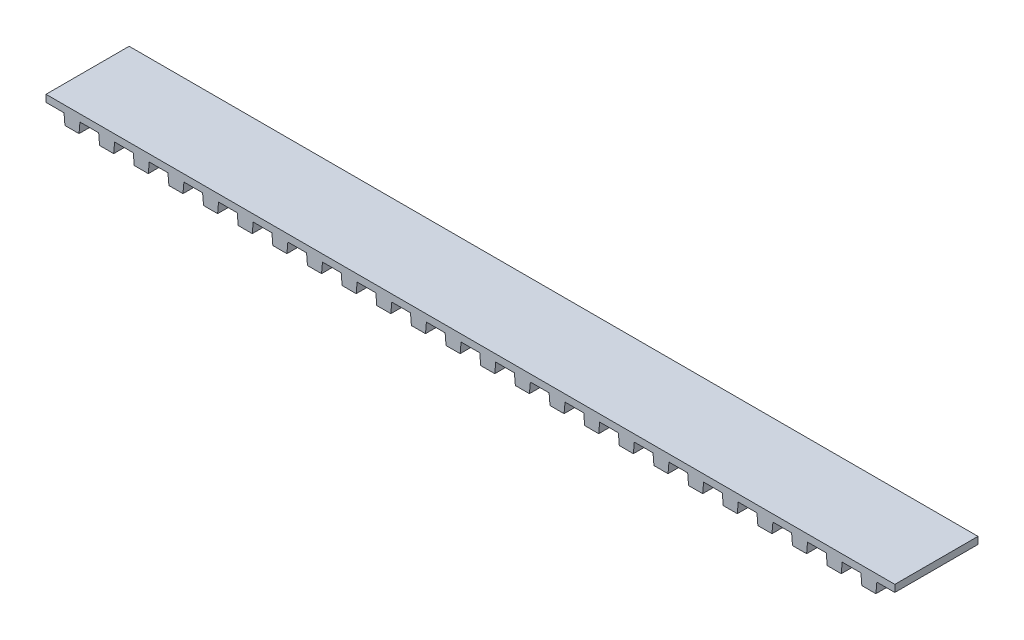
SolidWorks part; units mm, degrees
ref_plane "Front" through (0, 0, 0) normal (0, 0, 1) x (1, 0, 0)
ref_plane "Top" through (0, 0, 0) normal (0, 1, 0) x (1, 0, 0)
ref_plane "Right" through (0, 0, 0) normal (1, 0, 0) x (0, 0, -1)
sketch "Sketch1" plane through (0, 0, 0) normal (0, 0, 1) x (1, 0, 0)
  line L1 (0, 0.762) -> (30.625, 0.762)
  line L2 (0, 0.762) -> (0, 1.27)
  line L3 (0, 1.27) -> (30.625, 1.27)
  line L4 (30.625, 0.762) -> (30.625, 1.27)
  dimension "D1" = 30.625
  dimension "D2" = 0.508
  dimension "D3" = 0.762
extrude "Extrude1" add sketch "Sketch1" along normal blind 6
sketch "Sketch2" plane through (0, 0, 0) normal (0, 0, 1) x (1, 0, 0)
  line L0 (0.6753, 0.762) -> (0.742, 0)
  line L1 (0, 0.762) -> (30.625, 0.762) construction
  line L2 (0.742, 0) -> (1.758, 0)
  line L3 (1.758, 0) -> (1.8247, 0.762)
  line L4 (0.6753, 0.762) -> (1.8247, 0.762)
  point P6 (1.25, 0)
  dimension "D1" = 1.016
  dimension "D2" = 95
  dimension "D3" = 95
  dimension "D4" = 1.25
extrude "Extrude2" add sketch "Sketch2" along normal up to surface (6 mm away)
pattern_linear "LPattern1" count 12 spacing 2.5 along (1, 0, 0) of "Extrude2"
mirror "Mirror1" about plane through (0, 0, 0) normal (1, 0, 0)
